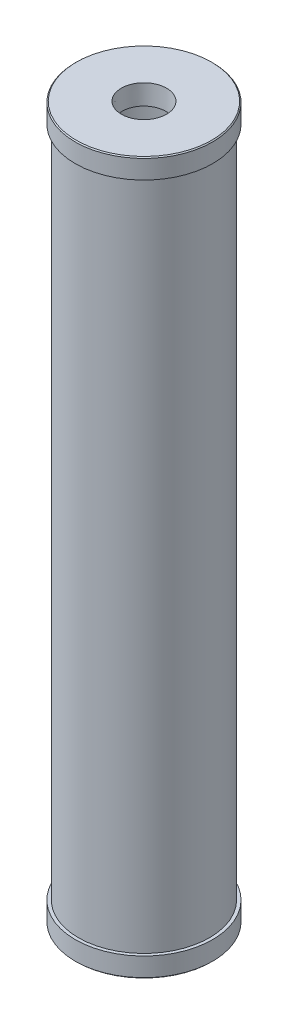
SolidWorks part; units mm, degrees
ref_plane "Front Plane" through (0, 0, 0) normal (0, 0, 1) x (1, 0, 0)
ref_plane "Top Plane" through (0, 0, 0) normal (0, 1, 0) x (1, 0, 0)
ref_plane "Right Plane" through (0, 0, 0) normal (1, 0, 0) x (0, 0, -1)
sketch "Sketch1" plane through (0, 0, 0) normal (0, 1, 0) x (1, 0, 0)
  circle A0 centre (0, 0) radius 84.201
  circle A1 centre (0, 0) radius 74.676
  dimension "D1" = 168.402
  dimension "D2" = 9.525
extrude "Boss-Extrude1" add sketch "Sketch1" along normal blind 914.4
ref_plane "Plane1" through (0, 914.4, 0) normal (0, 1, 0) x (1, 0, 0)
sketch "Sketch2" plane through (0, 0, 0) normal (0, 1, 0) x (1, 0, 0)
  circle A0 centre (0, 0) radius 88.265
  dimension "D1" = 176.53
extrude "Boss-Extrude2" add sketch "Sketch2" along normal blind 25.4
sketch "Sketch3" plane through (0, 914.4, 0) normal (0, 1, 0) x (1, 0, 0)
  circle A0 centre (0, 0) radius 88.265
  dimension "D1" = 176.53
extrude "Boss-Extrude3" add sketch "Sketch3" against normal blind 25.4
hole_wizard "2 Rc Tapped Hole1" positions "Sketch5" profile "Sketch4" size "2" standard "BSI"
sketch "Sketch5" plane through (0, 914.4, 0) normal (0, 1, 0) x (1, 0, 0)
  point P0 (0, 0)
sketch "Sketch4" plane through (0, 914.4, 0) normal (1, 0, 0) x (0, 0, 1)
  line L0 (0, 0) -> (0, 53.5476)
  line L1 (27.4, 37.084) -> (0, 53.5476)
  line L2 (-27.4, 37.084) -> (0, 53.5476) construction
  line L3 (27.4, 37.084) -> (27.4, 25.654)
  line L4 (27.4, 25.654) -> (28.2652, 25.654)
  line L5 (28.2652, 25.654) -> (29.0661, 0)
  line L6 (-28.2652, 25.654) -> (-29.0661, 0) construction
  line L7 (29.0661, 0) -> (0, 0)
  line L8 (0, -6.35) -> (0, 107.95) construction
  line L11 (-27.4, 25.654) -> (-28.2652, 25.654) construction
  dimension "Tap Drill Dia." = 54.8
  dimension "Tap Drill Depth" = 37.084
  dimension "Thread Dia." = 58.1321
  dimension "Thread Angle" = 3.576
  dimension "Thread Depth" = 25.654
  dimension "Drill Angle" = 118
hole_wizard "2 Rc Tapped Hole2" positions "Sketch11" profile "Sketch10" size "2" standard "BSI"
sketch "Sketch11" plane through (0, 0, 0) normal (0, 1, 0) x (1, 0, 0)
  point P0 (0, 0)
sketch "Sketch10" plane through (0, 0, 0) normal (1, 0, 0) x (0, 0, -1)
  line L0 (0, 0) -> (0, 53.5476)
  line L1 (27.4, 37.084) -> (0, 53.5476)
  line L2 (-27.4, 37.084) -> (0, 53.5476) construction
  line L3 (27.4, 37.084) -> (27.4, 25.654)
  line L4 (27.4, 25.654) -> (28.2652, 25.654)
  line L5 (28.2652, 25.654) -> (29.0661, 0)
  line L6 (-28.2652, 25.654) -> (-29.0661, 0) construction
  line L7 (29.0661, 0) -> (0, 0)
  line L8 (0, -6.35) -> (0, 107.95) construction
  line L11 (-27.4, 25.654) -> (-28.2652, 25.654) construction
  dimension "Tap Drill Dia." = 54.8
  dimension "Tap Drill Depth" = 37.084
  dimension "Thread Dia." = 58.1321
  dimension "Thread Angle" = 3.576
  dimension "Thread Depth" = 25.654
  dimension "Drill Angle" = 118
chamfer "Chamfer1" distance 1.27 angle 45 2 edges at (0, 0, 88.265) (0, 914.4, 88.265)
